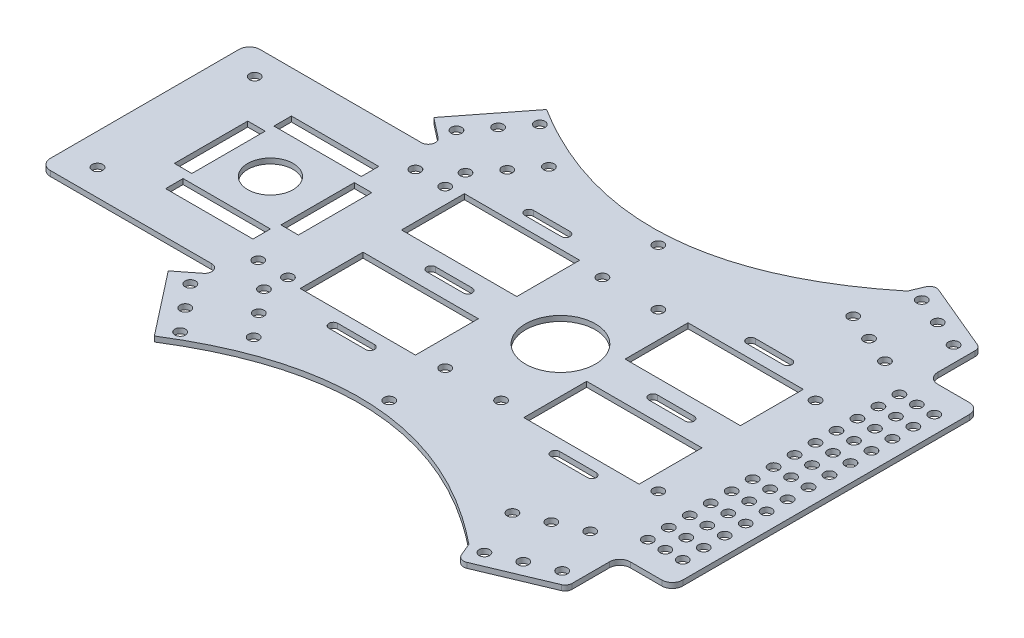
SolidWorks part; units mm, degrees
ref_plane "Спереди" through (0, 0, 0) normal (0, 0, 1) x (1, 0, 0)
ref_plane "Сверху" through (0, 0, 0) normal (0, 1, 0) x (1, 0, 0)
ref_plane "Справа" through (0, 0, 0) normal (1, 0, 0) x (0, 0, -1)
sketch "Эскиз1" plane through (0, 0, 0) normal (0, 1, 0) x (1, 0, 0)
  line L0 (-19.0468, 0) -> (190.9532, 0) construction
  line L1 (0, -27) -> (0, 27)
  line L2 (3, 30) -> (49.1883, 30)
  line L3 (50.419, 33.5765) -> (44.753, 38)
  line L4 (44.753, 38) -> (58.9069, 56.1292)
  line L5 (195, -41) -> (195, 41)
  line L6 (192, 44) -> (183, 44)
  line L7 (180, 47) -> (180, 57.6706)
  line L8 (178.7742, 59.5146) -> (159.7152, 67.5162)
  line L9 (157.0969, 66.4463) -> (155.5485, 62.7581)
  line L10 (157.0969, -66.4463) -> (155.5485, -62.7581)
  line L11 (178.7742, -59.5146) -> (159.7152, -67.5162)
  line L12 (180, -47) -> (180, -57.6706)
  line L13 (192, -44) -> (183, -44)
  line L14 (44.753, -38) -> (58.9069, -56.1292)
  line L15 (50.419, -33.5765) -> (44.753, -38)
  line L16 (3, -30) -> (49.1883, -30)
  arc A0 (0, 27) -> (3, 30) centre (3, 27) cw
  arc A1 (49.1883, 30) -> (50.419, 33.5765) centre (49.1883, 32) ccw
  arc A2 (180, 57.6706) -> (178.7742, 59.5146) centre (178, 57.6706) ccw
  arc A3 (159.7152, 67.5162) -> (157.0969, 66.4463) centre (158.941, 65.6721) ccw
  arc A4 (195, 41) -> (192, 44) centre (192, 41) ccw
  arc A5 (183, 44) -> (180, 47) centre (183, 47) cw
  arc A6 (183, -44) -> (180, -47) centre (183, -47) ccw
  arc A7 (195, -41) -> (192, -44) centre (192, -41) cw
  arc A8 (159.7152, -67.5162) -> (157.0969, -66.4463) centre (158.941, -65.6721) cw
  arc A9 (180, -57.6706) -> (178.7742, -59.5146) centre (178, -57.6706) cw
  arc A10 (49.1883, -30) -> (50.419, -33.5765) centre (49.1883, -32) cw
  arc A11 (0, -27) -> (3, -30) centre (3, -27) ccw
  spline S0 degree 2 poles (58.9069, 56.1292) (108.8246, 24.8356) (155.5485, 62.7581) knots 0 0 0 1 1 1
  spline S1 degree 2 poles (58.9069, -56.1292) (108.8246, -24.8356) (155.5485, -62.7581) knots 0 0 0 1 1 1
  point P17 (0, 30)
  point P20 (55, 30)
  point P23 (180, 59)
  point P26 (157.8711, 68.2904)
  point P29 (195, 44)
  point P32 (180, 44)
  point P34 (195, 0)
  point P35 (0, 0)
  point P55 (180, -44)
  point P56 (195, -44)
  point P57 (157.8711, -68.2904)
  point P58 (180, -59)
  point P59 (55, -30)
  point P60 (0, -30)
  dimension "D12" = 3
  dimension "D13" = 2
  dimension "D14" = 2
  dimension "D15" = 3
  dimension "D1" = 55
  dimension "D2" = 13
  dimension "D3" = 8
  dimension "D4" = 23
  dimension "D5" = 44
  dimension "D6" = 195
  dimension "D7" = 15
  dimension "D8" = 15
  dimension "D9" = 24
  dimension "D10" = 90
  dimension "D11" = 42
extrude "Бобышка-Вытянуть2" add sketch "Эскиз1" along normal blind 1.5
sketch "Эскиз5" plane through (0, 1.5, 0) normal (0, 1, 0) x (1, 0, 0)
  line L0 (0, 27) -> (0, -27) construction
  line L1 (19, -10.5) -> (24, -10.5)
  line L2 (19, -10.5) -> (19, 10.5)
  line L3 (19, 10.5) -> (24, 10.5)
  line L4 (24, -10.5) -> (24, 10.5)
  line L5 (19, -10.5) -> (24, 10.5) construction
  line L6 (19, 10.5) -> (24, -10.5) construction
  line L7 (49.5, 10.5) -> (54.5, 10.5)
  line L8 (49.5, 10.5) -> (49.5, -10.5)
  line L9 (49.5, -10.5) -> (54.5, -10.5)
  line L10 (54.5, 10.5) -> (54.5, -10.5)
  line L11 (49.5, 10.5) -> (54.5, -10.5) construction
  line L12 (49.5, -10.5) -> (54.5, 10.5) construction
  line L13 (24, 18) -> (49, 18)
  line L14 (24, 18) -> (24, 13)
  line L15 (24, 13) -> (49, 13)
  line L16 (49, 18) -> (49, 13)
  line L17 (24, 18) -> (49, 13) construction
  line L18 (24, 13) -> (49, 18) construction
  line L19 (24, -13) -> (49, -13)
  line L20 (24, -13) -> (24, -18)
  line L21 (24, -18) -> (49, -18)
  line L22 (49, -13) -> (49, -18)
  line L23 (24, -13) -> (49, -18) construction
  line L24 (24, -18) -> (49, -13) construction
  line L25 (49.1883, 30) -> (3, 30) construction
  line L26 (3, -30) -> (49.1883, -30) construction
  circle A0 centre (36, 0) radius 6.5
  point P0 (21.5, 0)
  point P5 (52, 0)
  point P10 (36.5, 15.5)
  point P15 (36.5, -15.5)
  dimension "D1" = 21
  dimension "D2" = 5
  dimension "D3" = 21
  dimension "D4" = 5
  dimension "D5" = 19
  dimension "D6" = 30
  dimension "D7" = 30
  dimension "D8" = 52
  dimension "D9" = 36
  dimension "D10" = 25
  dimension "D11" = 5
  dimension "D12" = 5
  dimension "D13" = 25
  dimension "D14" = 24
  dimension "D15" = 49
  dimension "D16" = 12
  dimension "D17" = 12
extrude "дыры под мозгом" cut sketch "Эскиз5" against normal through all
sketch "Эскиз6" plane through (0, 1.5, 0) normal (0, 1, 0) x (1, 0, 0)
  line L0 (-28.3535, 0) -> (207.1956, 0) construction
  line L1 (0, 27) -> (0, -27) construction
  line L2 (68, 5.5) -> (101, 5.5)
  line L3 (68, 5.5) -> (68, 23.5)
  line L4 (68, 23.5) -> (101, 23.5)
  line L5 (101, 5.5) -> (101, 23.5)
  line L6 (132, 23.5) -> (165, 23.5)
  line L7 (132, 23.5) -> (132, 5.5)
  line L8 (132, 5.5) -> (165, 5.5)
  line L9 (165, 23.5) -> (165, 5.5)
  line L10 (195, -41) -> (195, 41) construction
  line L11 (145.5, 0) -> (156, 0) construction
  line L12 (145.5, 1.25) -> (156, 1.25)
  line L13 (145.5, -1.25) -> (156, -1.25)
  line L14 (82, 0) -> (92.5, 0) construction
  line L15 (82, 1.25) -> (92.5, 1.25)
  line L16 (82, -1.25) -> (92.5, -1.25)
  line L17 (145.5, 28) -> (156, 28) construction
  line L18 (145.5, 29.25) -> (156, 29.25)
  line L19 (145.5, 26.75) -> (156, 26.75)
  line L20 (82, 28) -> (92.5, 28) construction
  line L21 (82, 29.25) -> (92.5, 29.25)
  line L22 (82, 26.75) -> (92.5, 26.75)
  line L23 (145.5, -28) -> (156, -28) construction
  line L24 (145.5, -29.25) -> (156, -29.25)
  line L25 (145.5, -26.75) -> (156, -26.75)
  line L26 (82, -28) -> (92.5, -28) construction
  line L27 (82, -29.25) -> (92.5, -29.25)
  line L28 (82, -26.75) -> (92.5, -26.75)
  line L29 (165, -23.5) -> (165, -5.5)
  line L30 (132, -5.5) -> (165, -5.5)
  line L31 (132, -23.5) -> (132, -5.5)
  line L32 (132, -23.5) -> (165, -23.5)
  line L33 (101, -5.5) -> (101, -23.5)
  line L34 (68, -23.5) -> (101, -23.5)
  line L35 (68, -5.5) -> (68, -23.5)
  line L36 (68, -5.5) -> (101, -5.5)
  circle A0 centre (119, 0) radius 10
  arc A1 (145.5, 1.25) -> (145.5, -1.25) centre (145.5, 0) ccw
  arc A2 (156, -1.25) -> (156, 1.25) centre (156, 0) ccw
  arc A3 (82, 1.25) -> (82, -1.25) centre (82, 0) ccw
  arc A4 (92.5, -1.25) -> (92.5, 1.25) centre (92.5, 0) ccw
  arc A5 (145.5, 29.25) -> (145.5, 26.75) centre (145.5, 28) ccw
  arc A6 (156, 26.75) -> (156, 29.25) centre (156, 28) ccw
  arc A7 (82, 29.25) -> (82, 26.75) centre (82, 28) ccw
  arc A8 (92.5, 26.75) -> (92.5, 29.25) centre (92.5, 28) ccw
  arc A9 (145.5, -29.25) -> (145.5, -26.75) centre (145.5, -28) cw
  arc A10 (156, -26.75) -> (156, -29.25) centre (156, -28) cw
  arc A11 (82, -29.25) -> (82, -26.75) centre (82, -28) cw
  arc A12 (92.5, -26.75) -> (92.5, -29.25) centre (92.5, -28) cw
  point P19 (150.75, 0)
  point P26 (87.25, 0)
  point P33 (150.75, 28)
  point P40 (87.25, 28)
  point P47 (150.75, -28)
  point P54 (87.25, -28)
  dimension "D9" = 76
  dimension "D1" = 18
  dimension "D2" = 33
  dimension "D3" = 18
  dimension "D4" = 33
  dimension "D5" = 5.5
  dimension "D6" = 5.5
  dimension "D7" = 68
  dimension "D8" = 30
  dimension "D10" = 2.5
  dimension "D11" = 10.5
  dimension "D12" = 39
  dimension "D13" = 82
extrude "дыры центр" cut sketch "Эскиз6" against normal through all
sketch "Эскиз7" plane through (0, 1.5, 0) normal (0, 1, 0) x (1, 0, 0)
  line L0 (195, -41) -> (195, 41) construction
  line L1 (192, 44) -> (183, 44) construction
  circle A0 centre (190, 36) radius 1.5
  circle A1 centre (185, 36) radius 1.5
  circle A2 centre (180, 36) radius 1.5
  circle A3 centre (190, 30) radius 1.5
  circle A4 centre (185, 30) radius 1.5
  circle A5 centre (180, 30) radius 1.5
  circle A6 centre (190, 24) radius 1.5
  circle A7 centre (185, 24) radius 1.5
  circle A8 centre (180, 24) radius 1.5
  circle A9 centre (190, 18) radius 1.5
  circle A10 centre (185, 18) radius 1.5
  circle A11 centre (180, 18) radius 1.5
  circle A12 centre (190, 12) radius 1.5
  circle A13 centre (185, 12) radius 1.5
  circle A14 centre (180, 12) radius 1.5
  circle A15 centre (190, 6) radius 1.5
  circle A16 centre (185, 6) radius 1.5
  circle A17 centre (180, 6) radius 1.5
  circle A18 centre (190, 0) radius 1.5
  circle A19 centre (185, 0) radius 1.5
  circle A20 centre (180, 0) radius 1.5
  circle A21 centre (190, -6) radius 1.5
  circle A22 centre (185, -6) radius 1.5
  circle A23 centre (180, -6) radius 1.5
  circle A24 centre (190, -12) radius 1.5
  circle A25 centre (185, -12) radius 1.5
  circle A26 centre (180, -12) radius 1.5
  circle A27 centre (190, -18) radius 1.5
  circle A28 centre (185, -18) radius 1.5
  circle A29 centre (180, -18) radius 1.5
  circle A30 centre (190, -24) radius 1.5
  circle A31 centre (185, -24) radius 1.5
  circle A32 centre (180, -24) radius 1.5
  circle A33 centre (190, -30) radius 1.5
  circle A34 centre (185, -30) radius 1.5
  circle A35 centre (180, -30) radius 1.5
  circle A36 centre (190, -36) radius 1.5
  circle A37 centre (185, -36) radius 1.5
  circle A38 centre (180, -36) radius 1.5
  dimension "D1" = 3
  dimension "D2" = 3
  dimension "D3" = 3
  dimension "D4" = 5
  dimension "D5" = 5
  dimension "D6" = 5
  dimension "D7" = 8
  dimension "D8" = 13
extrude "масив отв перед" cut sketch "Эскиз7" against normal through all
sketch "Эскиз8" plane through (0, 1.5, 0) normal (0, 1, 0) x (1, 0, 0)
  line L0 (44.753, 38) -> (50.419, 33.5765) construction
  line L1 (58.9069, 56.1292) -> (44.753, 38) construction
  line L2 (157.0969, 66.4463) -> (155.5485, 62.7581) construction
  line L3 (178.7742, 59.5146) -> (159.7152, 67.5162) construction
  line L4 (-22.3731, 0) -> (210.2854, 0) construction
  circle A0 centre (51.1557, 38.076) radius 1.5
  circle A1 centre (56.3865, 44.7759) radius 1.5
  circle A2 centre (61.6173, 51.4758) radius 1.5
  circle A3 centre (62.9791, 28.8452) radius 1.5
  circle A4 centre (68.2099, 35.5451) radius 1.5
  circle A5 centre (73.4407, 42.2451) radius 1.5
  circle A6 centre (159.8173, 62.5928) radius 1.5
  circle A7 centre (167.6546, 59.3025) radius 1.5
  circle A8 centre (175.4919, 56.0121) radius 1.5
  circle A9 centre (154.0108, 48.7622) radius 1.5
  circle A10 centre (161.8481, 45.4719) radius 1.5
  circle A11 centre (169.6855, 42.1815) radius 1.5
  circle A12 centre (159.8173, -62.5928) radius 1.5
  circle A13 centre (167.6546, -59.3025) radius 1.5
  circle A14 centre (175.4919, -56.0121) radius 1.5
  circle A15 centre (169.6855, -42.1815) radius 1.5
  circle A16 centre (161.8481, -45.4719) radius 1.5
  circle A17 centre (154.0108, -48.7622) radius 1.5
  circle A18 centre (51.1557, -38.076) radius 1.5
  circle A19 centre (62.9791, -28.8452) radius 1.5
  circle A20 centre (68.2099, -35.5451) radius 1.5
  circle A21 centre (56.3865, -44.7759) radius 1.5
  circle A22 centre (61.6173, -51.4758) radius 1.5
  circle A23 centre (73.4407, -42.2451) radius 1.5
  dimension "D1" = 3
  dimension "D2" = 3
  dimension "D3" = 3
  dimension "D8" = 3
  dimension "D9" = 3
  dimension "D10" = 3
  dimension "D4" = 4
  dimension "D5" = 8.5
  dimension "D6" = 8.5
  dimension "D7" = 5
  dimension "D11" = 4
  dimension "D12" = 4.5
  dimension "D13" = 4.5
  dimension "D14" = 4.5
  dimension "D15" = 8.5
  dimension "D16" = 8.5
  dimension "D17" = 2
  dimension "D18" = 2
extrude "отв под лучи" cut sketch "Эскиз8" against normal through all
sketch "Эскиз9" plane through (0, 1.5, 0) normal (0, 1, 0) x (1, 0, 0)
  line L0 (0, 27) -> (0, -27) construction
  line L1 (49.1883, 30) -> (3, 30) construction
  line L3 (-6.9656, 0) -> (200.3409, 0) construction
  circle A0 centre (9, 22.5) radius 1.5
  circle A1 centre (63.5, 22.5) radius 1.5
  circle A2 centre (55, 22.5) radius 1.5
  circle A3 centre (108.5, 22.5) radius 1.5
  circle A4 centre (124.5, 22.5) radius 1.5
  circle A5 centre (169.5, 22.5) radius 1.5
  circle A6 centre (108.5, 38.5) radius 1.5
  circle A7 centre (169.5, -22.5) radius 1.5
  circle A8 centre (124.5, -22.5) radius 1.5
  circle A9 centre (108.5, -38.5) radius 1.5
  circle A10 centre (108.5, -22.5) radius 1.5
  circle A11 centre (63.5, -22.5) radius 1.5
  circle A12 centre (55, -22.5) radius 1.5
  circle A13 centre (9, -22.5) radius 1.5
  dimension "D1" = 9
  dimension "D13" = 16
  dimension "D2" = 7.5
  dimension "D3" = 7.5
  dimension "D4" = 7.5
  dimension "D5" = 7.5
  dimension "D6" = 7.5
  dimension "D7" = 7.5
  dimension "D8" = 46
  dimension "D9" = 8.5
  dimension "D10" = 45
  dimension "D11" = 16
  dimension "D12" = 45
extrude "креп отв" cut sketch "Эскиз9" against normal through all
